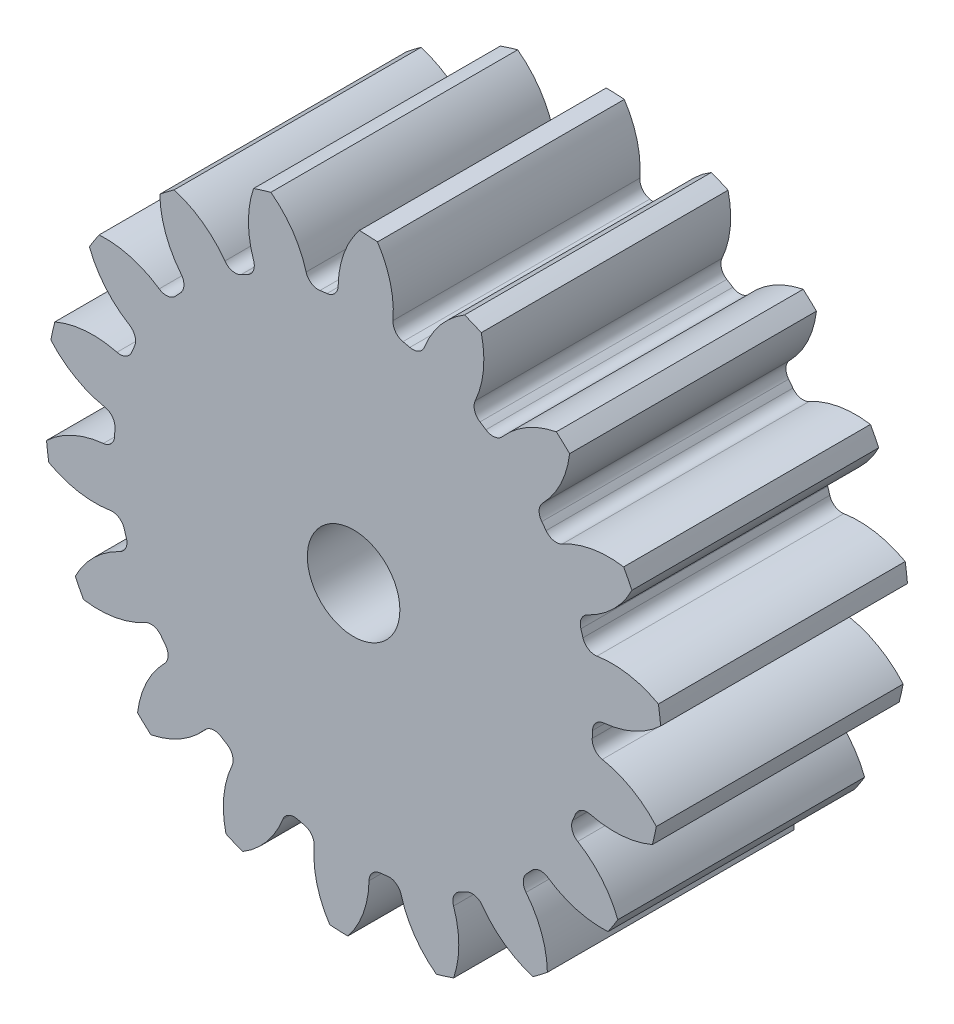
SolidWorks part; units mm, degrees
ref_plane "Front" through (0, 0, 0) normal (0, 0, 1) x (1, 0, 0)
ref_plane "Top" through (0, 0, 0) normal (0, 1, 0) x (1, 0, 0)
ref_plane "Right" through (0, 0, 0) normal (1, 0, 0) x (0, 0, -1)
sketch "Sketch3" plane through (0, 0, 0) normal (0, 0, 1) x (1, 0, 0)
  circle A0 centre (0, 0) radius 127
  dimension "od" = 254
extrude "gearBody" add sketch "Sketch3" along normal blind 101.6
sketch "Sketch2" plane through (0, 0, 0) normal (0, 0, 1) x (1, 0, 0)
  line L0 (0, 0) -> (99.231, 41.1028) construction
  line L1 (125.1702, -25.0395) -> (0, 0) construction
  line L2 (0, 0) -> (36.3143, 0) construction
  line L3 (114.2136, 4.4435) -> (113.2546, -15.4237) construction
  line L5 (113.7341, -5.4901) -> (0, 0) construction
  line L7 (0, 0) -> (107.4069, 0) construction
  arc A0 (107.3812, 2.3477) -> (106.6558, -12.6795) centre (0, 0) ccw construction
  arc A1 (126.4037, 12.2926) -> (124.632, -24.4104) centre (0, 0) ccw construction
  arc A2 (114.2136, 4.4435) -> (113.2546, -15.4237) centre (0, 0) ccw construction
  arc A3 (98.2294, -6.2014) -> (98.37, -3.2887) centre (0, 0) ccw
  arc A4 (125.1702, -25.0395) -> (102.3978, -11.6002) centre (94.8107, -50.4694) ccw
  arc A5 (125.1702, -25.0395) -> (127, 12.8669) centre (0, 0) ccw
  arc A6 (127, 12.8669) -> (103.039, 1.6835) centre (99.231, 41.1028) cw
  arc A7 (98.37, -3.2887) -> (103.039, 1.6835) centre (103.5361, -3.4614) cw
  arc A8 (102.3978, -11.6002) -> (98.2294, -6.2014) centre (103.3881, -6.527) cw
  point P6 (127, 12.8669)
  point P22 (125.1702, -25.0395)
  dimension "baseDia" = 214.8137
  dimension "od" = 254
  dimension "pd" = 228.6
  dimension "rd" = 196.85
  dimension "rFillet" = 5.1689
  dimension "pointX" = 127
  dimension "pointY" = 12.8669
  dimension "CTT" = 19.8672
  dimension "flankCenterAngle" = 22.5
extrude "toothCut" cut sketch "Sketch2" along normal through all
pattern_circular "CirPattern1" count 18 over 360 about axis through (0, 0, 0) along (0, 0, 1) of "toothCut"
sketch "hub1Dia" plane through (0, 0, 0) normal (0, 0, -1) x (-1, 0, 0)
  circle A0 centre (0, 0) radius 12.7
  dimension "hub1Dia" = 25.4
sketch "hub2Dia" plane through (0, 0, 101.6) normal (0, 0, 1) x (1, 0, 0)
  circle A0 centre (0, 0) radius 12.7
  dimension "hub2dia" = 25.4
sketch "boreDia" plane through (0, 0, 0) normal (0, 0, 1) x (1, 0, 0)
  circle A0 centre (0, 0) radius 19.05
  dimension "boreDia" = 38.1
extrude "bore" cut sketch "boreDia" against normal mid plane 25400
